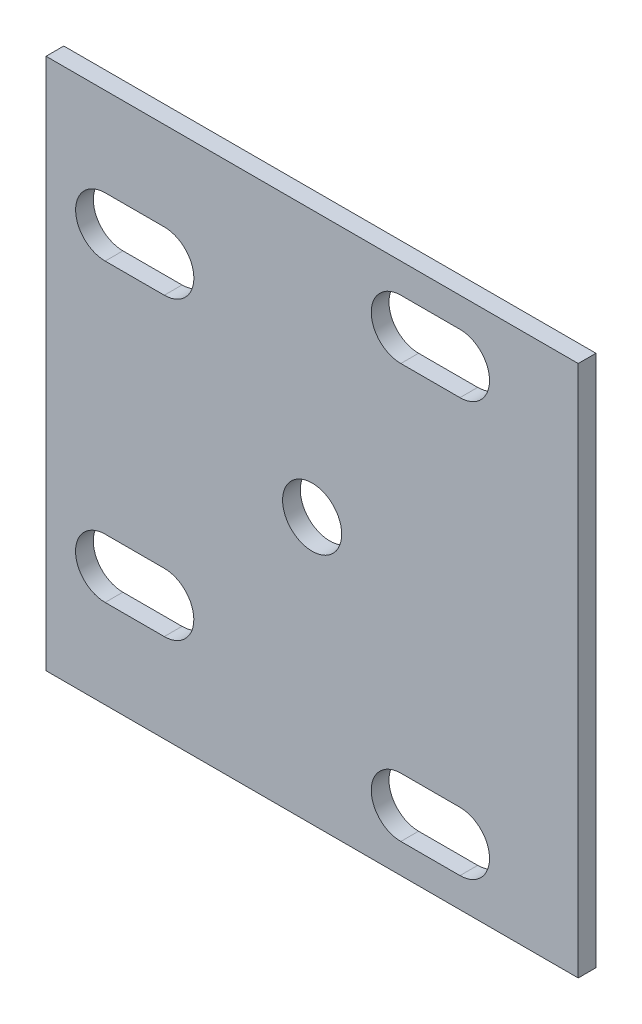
SolidWorks part; units mm, degrees
ref_plane "Plan de face" through (0, 0, 0) normal (0, 0, 1) x (1, 0, 0)
ref_plane "Plan de dessus" through (0, 0, 0) normal (0, 1, 0) x (1, 0, 0)
ref_plane "Plan de droite" through (0, 0, 0) normal (1, 0, 0) x (0, 0, -1)
sketch "Esquisse1" plane through (0, 0, 0) normal (0, 0, 1) x (1, 0, 0)
  line L0 (10, 70) -> (70, 70) construction
  line L1 (0, 0) -> (90, 0)
  line L2 (0, 0) -> (0, 90)
  line L3 (0, 90) -> (90, 90)
  line L4 (90, 0) -> (90, 90)
  line L5 (70, 70) -> (70, 10) construction
  line L6 (70, 10) -> (10, 10) construction
  line L7 (10, 10) -> (10, 70) construction
  line L8 (10, 75) -> (20, 75)
  line L9 (20, 65) -> (10, 65)
  line L10 (9.9912, 25) -> (19.9912, 25)
  line L11 (19.9912, 15) -> (9.9912, 15)
  line L12 (70, 85) -> (60, 85)
  line L13 (70, 75) -> (60, 75)
  line L14 (60, 15) -> (70, 15)
  line L15 (70, 5) -> (60, 5)
  line L16 (0, 90) -> (90, 0) construction
  line L17 (90, 0) -> (89.104, 0.8895) construction
  line L18 (90, 90) -> (0, 0) construction
  arc A0 (10, 65) -> (10, 75) centre (10, 70) cw
  arc A1 (9.9912, 15) -> (9.9912, 25) centre (9.9912, 20) cw
  arc A2 (19.9912, 15) -> (19.9912, 25) centre (19.9912, 20) ccw
  arc A3 (20, 65) -> (20, 75) centre (20, 70) ccw
  arc A4 (60, 85) -> (60, 75) centre (60, 80) ccw
  arc A5 (70, 75) -> (70, 85) centre (70, 80) ccw
  arc A6 (60, 5) -> (60, 15) centre (60, 10) cw
  arc A7 (70, 5) -> (70, 15) centre (70, 10) ccw
  circle A8 centre (45, 45) radius 5
  dimension "D3" = 60
  dimension "D7" = 10
  dimension "D11" = 10
  dimension "D14" = 5
  dimension "D15" = 5
  dimension "D16" = 5
  dimension "D1" = 90
  dimension "D2" = 90
  dimension "D4" = 20
  dimension "D5" = 60
  dimension "D6" = 10
  dimension "D8" = 10
  dimension "D9" = 10
  dimension "D10" = 10
  dimension "D12" = 20
  dimension "D13" = 10
  dimension "D17" = 60
extrude "Boss.-Extru.1" add sketch "Esquisse1" along normal blind 3 contours L3 L4 L1 L2
